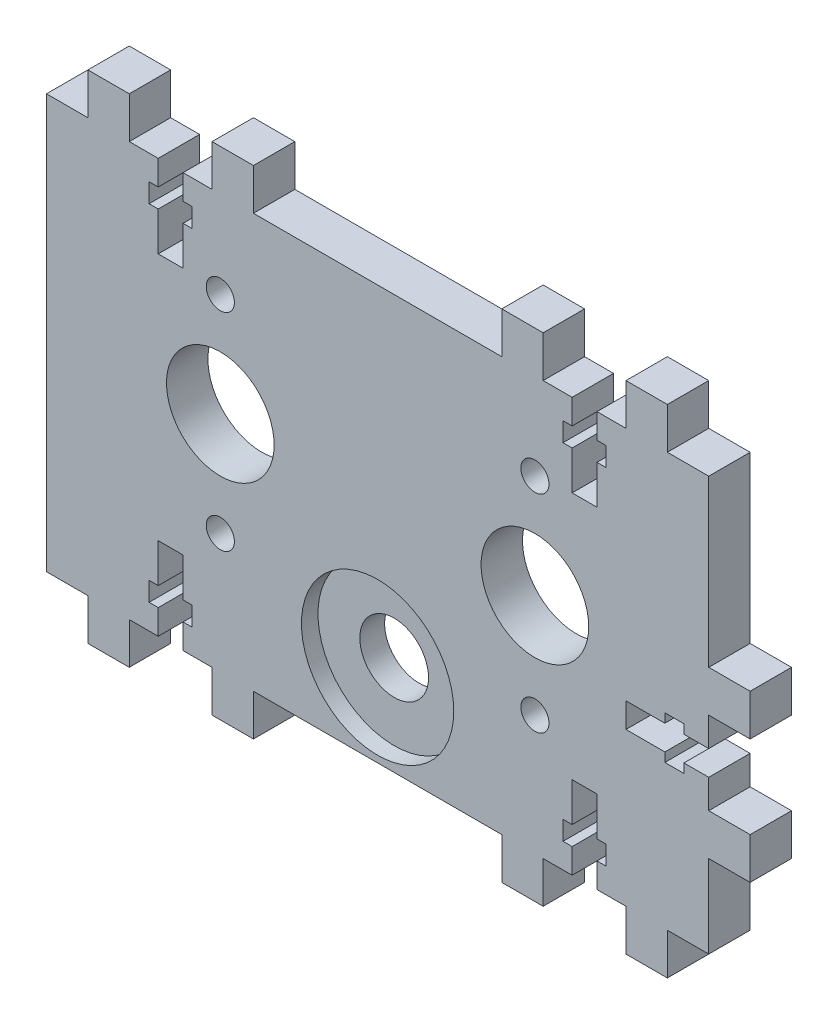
SolidWorks part; units mm, degrees
ref_plane "Plan de face" through (0, 0, 0) normal (0, 0, 1) x (1, 0, 0)
ref_plane "Plan de dessus" through (0, 0, 0) normal (0, 1, 0) x (1, 0, 0)
ref_plane "Plan de droite" through (0, 0, 0) normal (1, 0, 0) x (0, 0, -1)
sketch "Esquisse1" plane through (0, 0, 0) normal (0, 0, 1) x (1, 0, 0)
  line L0 (76.5, 27.0074) -> (38.3954, 27.0074) construction
  line L1 (59, -9.8996) -> (59, -47.7723) construction
  line L2 (5, 0) -> (0, 0)
  line L3 (0, 0) -> (90, 0) construction
  line L4 (5, 50) -> (0, 50)
  line L5 (80, 50) -> (0, 50) construction
  line L8 (75, 0) -> (80, 0)
  line L9 (40, 50) -> (40, 10) construction
  line L10 (0, 0) -> (0, 50)
  line L13 (25, 50) -> (55, 50)
  line L19 (21, -4.6567) -> (21, -54.5711) construction
  line L20 (40, -12.9256) -> (40, -31.1116) construction
  line L21 (4.3627, 27.0074) -> (32.8627, 27.0074) construction
  line L22 (16.9708, 39.5074) -> (25.0292, 39.5074) construction
  line L23 (16.9708, 14.5074) -> (25.0922, 14.5074) construction
  line L24 (29.8826, 10) -> (46.7465, 10) construction
  line L25 (80, 0) -> (80, 50) construction
  line L26 (80, 50) -> (75, 50)
  line L27 (80, 10) -> (80, 0)
  line L28 (80, 30) -> (80, 50)
  line L29 (80, 20) -> (68.7792, 20) construction
  line L30 (80, 18.5) -> (80, 15)
  line L31 (55, 0) -> (25, 0)
  line L32 (85, 15) -> (85, 10)
  line L33 (85, 10) -> (80, 10)
  line L34 (85, 15) -> (80, 15)
  line L35 (80, 21.5) -> (80, 25)
  line L36 (80, 25) -> (85, 25)
  line L37 (20, -2.1039) -> (20, -53.1998) construction
  line L38 (85, 25) -> (85, 30)
  line L39 (29.8826, 0.8961) -> (29.8826, -13.3072) construction
  line L40 (15, 0) -> (15, -12.5729) construction
  line L41 (85, 30) -> (80, 30)
  line L42 (65, 50) -> (65, 38.7792) construction
  line L43 (66.5, 50) -> (70, 50)
  line L44 (70, 55) -> (75, 55)
  line L45 (75, 55) -> (75, 50)
  line L46 (70, 55) -> (70, 50)
  line L47 (63.5, 50) -> (60, 50)
  line L48 (60, 50) -> (60, 55)
  line L49 (80, 18.5) -> (80, 21.5) construction
  line L50 (60, 55) -> (55, 55)
  line L51 (55, 55) -> (55, 50)
  line L52 (15, 50) -> (15, 38.7792) construction
  line L53 (16.5, 50) -> (20, 50)
  line L54 (20, 55) -> (25, 55)
  line L55 (25, 55) -> (25, 50)
  line L56 (20, 55) -> (20, 50)
  line L57 (13.5, 50) -> (10, 50)
  line L58 (10, 50) -> (10, 55)
  line L59 (10, 55) -> (5, 55)
  line L60 (5, 55) -> (5, 50)
  line L61 (15, 0) -> (15, 11.2208) construction
  line L62 (13.5, 0) -> (10, 0)
  line L63 (10, -5) -> (5, -5)
  line L64 (5, -5) -> (5, 0)
  line L65 (10, -5) -> (10, 0)
  line L66 (16.5, 0) -> (20, 0)
  line L67 (20, 0) -> (20, -5)
  line L68 (20, -5) -> (25, -5)
  line L69 (25, -5) -> (25, 0)
  line L70 (65, 0) -> (65, 11.2208) construction
  line L71 (63.5, 0) -> (60, 0)
  line L72 (60, -5) -> (55, -5)
  line L73 (55, -5) -> (55, 0)
  line L74 (60, -5) -> (60, 0)
  line L75 (66.5, 0) -> (70, 0)
  line L76 (70, 0) -> (70, -5)
  line L77 (70, -5) -> (75, -5)
  line L78 (75, -5) -> (75, 0)
  line L79 (80, 21.5) -> (77, 21.5)
  line L80 (74.7, 21.5) -> (74.7, 22.6)
  line L81 (77, 17.4) -> (74.7, 17.4)
  line L82 (77, 22.6) -> (77, 21.5)
  line L83 (74.7, 21.5) -> (70, 21.5)
  line L84 (70, 21.5) -> (70, 18.5)
  line L85 (70, 18.5) -> (74.7, 18.5)
  line L86 (77, 18.5) -> (77, 17.4)
  line L87 (74.7, 22.6) -> (77, 22.6)
  line L88 (74.7, 17.4) -> (74.7, 18.5)
  line L89 (77, 18.5) -> (80, 18.5)
  line L90 (70, 20) -> (80, 20) construction
  line L101 (63.5, 0) -> (66.5, 0) construction
  line L102 (66.5, 0) -> (66.5, 3)
  line L103 (66.5, 5.3) -> (67.6, 5.3)
  line L104 (62.4, 3) -> (62.4, 5.3)
  line L105 (67.6, 3) -> (66.5, 3)
  line L106 (66.5, 5.3) -> (66.5, 10)
  line L107 (66.5, 10) -> (63.5, 10)
  line L108 (63.5, 10) -> (63.5, 5.3)
  line L109 (63.5, 3) -> (62.4, 3)
  line L110 (67.6, 5.3) -> (67.6, 3)
  line L111 (62.4, 5.3) -> (63.5, 5.3)
  line L112 (63.5, 3) -> (63.5, 0)
  line L113 (65, 10) -> (65, 0) construction
  line L114 (13.5, 0) -> (16.5, 0) construction
  line L115 (16.5, 0) -> (16.5, 3)
  line L116 (16.5, 5.3) -> (17.6, 5.3)
  line L117 (12.4, 3) -> (12.4, 5.3)
  line L118 (17.6, 3) -> (16.5, 3)
  line L119 (16.5, 5.3) -> (16.5, 10)
  line L120 (16.5, 10) -> (13.5, 10)
  line L121 (13.5, 10) -> (13.5, 5.3)
  line L122 (13.5, 3) -> (12.4, 3)
  line L132 (17.6, 5.3) -> (17.6, 3)
  line L133 (12.4, 5.3) -> (13.5, 5.3)
  line L134 (13.5, 3) -> (13.5, 0)
  line L135 (15, 10) -> (15, 0) construction
  line L136 (16.5, 50) -> (13.5, 50) construction
  line L137 (13.5, 50) -> (13.5, 47)
  line L138 (13.5, 44.7) -> (12.4, 44.7)
  line L139 (17.6, 47) -> (17.6, 44.7)
  line L140 (12.4, 47) -> (13.5, 47)
  line L141 (13.5, 44.7) -> (13.5, 40)
  line L142 (13.5, 40) -> (16.5, 40)
  line L143 (16.5, 40) -> (16.5, 44.7)
  line L144 (16.5, 47) -> (17.6, 47)
  line L145 (12.4, 44.7) -> (12.4, 47)
  line L146 (17.6, 44.7) -> (16.5, 44.7)
  line L147 (16.5, 47) -> (16.5, 50)
  line L148 (15, 40) -> (15, 50) construction
  line L149 (66.5, 50) -> (63.5, 50) construction
  line L150 (63.5, 50) -> (63.5, 47)
  line L151 (63.5, 44.7) -> (62.4, 44.7)
  line L152 (67.6, 47) -> (67.6, 44.7)
  line L153 (62.4, 47) -> (63.5, 47)
  line L154 (63.5, 44.7) -> (63.5, 40)
  line L155 (63.5, 40) -> (66.5, 40)
  line L156 (66.5, 40) -> (66.5, 44.7)
  line L157 (66.5, 47) -> (67.6, 47)
  line L158 (62.4, 44.7) -> (62.4, 47)
  line L159 (67.6, 44.7) -> (66.5, 44.7)
  line L160 (66.5, 47) -> (66.5, 50)
  line L161 (65, 40) -> (65, 50) construction
  circle A0 centre (21, 39.5074) radius 1.7
  circle A1 centre (21, 14.5074) radius 1.7
  circle A2 centre (21, 27.0074) radius 6.5
  circle A3 centre (40, 10) radius 3.15
  circle A4 centre (21, 27.0074) radius 17.5 construction
  circle A5 centre (40, 10) radius 26.5 construction
  circle A6 centre (59, 27.0074) radius 6.5
  circle A7 centre (59, 14.5074) radius 1.7
  circle A8 centre (59, 39.5074) radius 1.7
  circle A9 centre (59, 27.0074) radius 17.5 construction
  point P65 (40, -2.1039)
  dimension "D13" = 3.4
  dimension "D14" = 3.4
  dimension "D15" = 13
  dimension "D17" = 6.3
  dimension "D3" = 35
  dimension "D4" = 53
  dimension "D2" = 25.5
  dimension "D5" = 12.5
  dimension "D6" = 38
  dimension "D7" = 25.5
  dimension "D8" = 50
  dimension "D9" = 40
  dimension "D10" = 50
  dimension "D11" = 12.5
  dimension "D12" = 12.5
  dimension "D16" = 10
  dimension "D18" = 10.1174
  dimension "D19" = 20
  dimension "D20" = 5
  dimension "D21" = 5
  dimension "D22" = 5.2
  dimension "D23" = 3
  dimension "D24" = 40
  dimension "D25" = 10
  dimension "D26" = 5
  dimension "D27" = 5
  dimension "D28" = 2.3
  dimension "D29" = 3
  dimension "D30" = 10
  dimension "D31" = 5
  dimension "D32" = 5
  dimension "D33" = 10
  dimension "D34" = 5
  dimension "D35" = 5
  dimension "D36" = 10
  dimension "D37" = 5
  dimension "D38" = 5
  dimension "D39" = 10
  dimension "D40" = 10
  dimension "D47" = 5.2
  dimension "D48" = 3
  dimension "D49" = 2.3
  dimension "D50" = 3
  dimension "D51" = 10
  dimension "D52" = 5.2
  dimension "D53" = 3
  dimension "D54" = 2.3
  dimension "D55" = 3
  dimension "D56" = 10
  dimension "D57" = 5.2
  dimension "D58" = 3
  dimension "D59" = 2.3
  dimension "D60" = 3
  dimension "D61" = 10
  dimension "D62" = 5.2
  dimension "D63" = 3
  dimension "D64" = 2.3
  dimension "D65" = 3
  dimension "D66" = 10
extrude "Boss.-Extru.1" add sketch "Esquisse1" along normal blind 5
sketch "Esquisse2" plane through (0, 0, 5) normal (0, 0, 1) x (1, 0, 0)
  circle A0 centre (40, 10) radius 9.2
  circle A1 centre (40, 10) radius 3.15 construction
  dimension "D1" = 18.4
extrude "Enlèv. mat.-Extru.1" cut sketch "Esquisse2" against normal blind 2
sketch "Esquisse3" plane through (0, 0, 3) normal (0, 0, 1) x (1, 0, 0)
  circle A0 centre (40, 10) radius 4.15
  circle A2 centre (40, 10) radius 3.15 construction
  dimension "D1" = 1
extrude "Enlèv. mat.-Extru.2" cut sketch "Esquisse3" against normal through all
